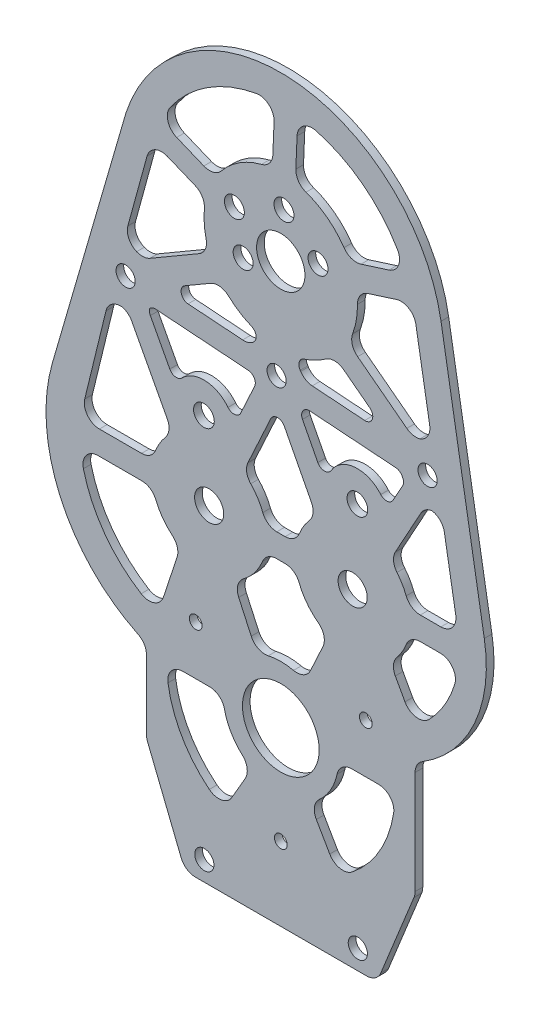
SolidWorks part; units mm, degrees
ref_plane "Front Plane" through (0, 0, 0) normal (0, 0, 1) x (1, 0, 0)
ref_plane "Top Plane" through (0, 0, 0) normal (0, 1, 0) x (1, 0, 0)
ref_plane "Right Plane" through (0, 0, 0) normal (1, 0, 0) x (0, 0, -1)
sketch "Sketch2" plane through (0, 0, 0) normal (0, 0, 1) x (1, 0, 0)
  line L0 (-51.4523, 75.7894) -> (48.4946, 68.6222) construction
  line L1 (22.6673, 116.9272) -> (41.2732, 122.8486)
  line L2 (4.7276, 130.6165) -> (5.527, 150.1256)
  line L3 (24.9782, 109.6661) -> (43.5841, 115.5874)
  line L4 (22.1726, 93.4838) -> (37.6993, 81.6448)
  line L5 (-0.1072, 105.6809) -> (84.2094, 132.5148) construction
  line L6 (-0.1072, 105.6809) -> (5.3603, 239.1239) construction
  line L7 (-2.886, 130.9285) -> (-2.0866, 150.4375)
  line L8 (-0.1072, 105.6809) -> (-82.9144, 139.7207) construction
  line L9 (-0.1072, 105.6809) -> (68.4071, 53.439) construction
  line L10 (-21.8854, 118.7527) -> (-39.9445, 126.1763)
  line L11 (-0.1072, 105.6809) -> (-86.0859, 55.6268) construction
  line L12 (-24.7826, 111.7049) -> (-42.8417, 119.1286)
  line L13 (-23.7269, 96.3389) -> (-45.8247, 83.4742)
  line L14 (-0.1072, 105.6809) -> (-1.4788, 72.2058) construction
  line L15 (-19.8931, 89.7536) -> (-38.8683, 78.7068)
  line L18 (-38.8683, 78.7068) -> (-9.9137, 76.6305)
  line L19 (7.5011, 75.3816) -> (36.0291, 73.3359)
  line L20 (17.5523, 87.4244) -> (36.0291, 73.3359)
  line L21 (51.6238, 69.1598) -> (44.0462, 113.2665) construction
  line L22 (37.6993, 81.6448) -> (43.8628, 76.9451)
  line L23 (44.0462, 113.2665) -> (50.1033, 78.0104)
  line L24 (39.5147, 65.4463) -> (5.0296, 67.9193)
  line L26 (47.6235, 59.1371) -> (36.0334, 38.0767)
  line L27 (-43.3163, 117.5151) -> (-52.1423, 85.2894)
  line L29 (-7.2441, 68.7995) -> (-43.0173, 71.3648)
  line L30 (-1.4788, 72.2058) -> (23.6962, 23.5612) construction
  line L31 (23.6962, 23.5612) -> (48.4946, 68.6222) construction
  line L32 (-51.4523, 75.7894) -> (-23.8033, 23.7713) construction
  line L33 (-23.8033, 23.7713) -> (-1.4788, 72.2058) construction
  line L34 (23.6962, 23.5612) -> (-23.8033, 23.7713) construction
  line L35 (-7.2441, 68.7995) -> (-15.5701, 50.7357)
  line L36 (-43.9907, 69.8691) -> (-34.8925, 52.752)
  line L37 (-1.2807, 63.5337) -> (-12.53, 39.1276)
  line L38 (-5.1215, 27.4987) -> (5.0482, 27.4537)
  line L39 (11.7336, 38.3868) -> (-1.2807, 63.5337)
  line L40 (40.9477, 62.811) -> (34.9343, 51.8841)
  line L42 (-50.7193, 66.2927) -> (-35.928, 38.4646)
  line L43 (51.656, 68.9461) -> (58.82, 27.3712) construction
  line L44 (23.6962, 23.5612) -> (99.3125, 23.5612) construction
  line L48 (-54.5366, 76.5428) -> (-66.4961, 27.5813) construction
  line L49 (-23.8033, 23.7713) -> (-96.1397, 23.7713) construction
  line L51 (-66.4961, 27.5813) -> (-42.4684, 27.5813)
  line L52 (42.3613, 27.3712) -> (58.82, 27.3712)
  line L53 (-42.4243, 19.7512) -> (-66.4769, 19.7512)
  line L54 (5.0311, 19.7512) -> (-5.1823, 19.7512)
  line L55 (58.82, 19.7512) -> (42.3613, 19.7512)
  line L57 (-0.0935, -28.0635) -> (67.2596, -28.0635) construction
  line L58 (-0.0935, -28.0635) -> (42.096, -101.1379) construction
  line L60 (18.7089, 12.7386) -> (-0.0935, -28.0635) construction
  line L61 (25.4, -78.4691) -> (-25.4, -78.4691) construction
  line L70 (-0.0935, -28.0635) -> (-26.1582, 28.9197) construction
  line L71 (-33.2594, 7.2339) -> (-40.7736, -15.5886)
  line L72 (-23.8033, 23.7713) -> (-39.6153, -24.2535) construction
  line L75 (-0.0935, -28.0635) -> (-35.6982, -89.7327) construction
  line L76 (36.019, 9.0336) -> (43.9402, -5.3936)
  line L81 (-0.0935, -28.0635) -> (-53.5455, -28.0635) construction
  line L85 (53.1443, 60.3092) -> (58.82, 27.3712)
  line L86 (-56.6675, 67.8191) -> (-66.4961, 27.5813)
  line L87 (-51.2911, 122.767) -> (-75.6689, 38.8356)
  line L88 (67.2596, 31.252) -> (52.9393, 115.0072)
  line L89 (44.3565, -15.6809) -> (44.3565, -53.7396)
  line L90 (44.3565, -53.7396) -> (31.7098, -84.9746)
  line L91 (31.7098, -84.9746) -> (-31.7902, -84.9746)
  line L92 (-31.7902, -84.9746) -> (-44.5435, -53.2246)
  line L93 (-44.5435, -53.2246) -> (-44.5435, -26.0967)
  line L95 (15.7234, 6.2599) -> (7.8793, -10.7622)
  line L96 (-15.8792, 6.4475) -> (-8.0176, -10.7398)
  line L97 (18.9565, -28.0635) -> (37.699, -28.0635)
  line L101 (9.4315, -44.5613) -> (18.8027, -60.7928)
  line L103 (-9.6185, -44.5613) -> (-18.9897, -60.7928)
  line L105 (-19.1435, -28.0635) -> (-37.886, -28.0635)
  line L106 (15.105, 48.4511) -> (5.0296, 67.9193)
  circle A0 centre (-1.4788, 72.2058) radius 3.175
  arc A1 (22.1726, 93.4838) -> (17.5523, 87.4244) centre (-0.1072, 105.6809) ccw construction
  arc A2 (44.0462, 113.2665) -> (37.6993, 81.6448) centre (-0.1072, 105.6809) ccw construction
  arc A3 (22.1726, 93.4838) -> (24.9782, 109.6661) centre (-0.1072, 105.6809) ccw
  arc A4 (22.6673, 116.9272) -> (4.7276, 130.6165) centre (-0.1072, 105.6809) ccw
  arc A5 (41.2732, 122.8486) -> (5.527, 150.1256) centre (-0.1072, 105.6809) ccw
  arc A6 (44.0462, 113.2665) -> (43.5841, 115.5874) centre (-0.1072, 105.6809) ccw
  arc A7 (-2.886, 130.9285) -> (-21.8854, 118.7527) centre (-0.1072, 105.6809) ccw
  arc A8 (-39.9445, 126.1763) -> (-2.0866, 150.4375) centre (-0.1072, 105.6809) cw
  arc A9 (-23.7269, 96.3389) -> (-24.7826, 111.7049) centre (-0.1072, 105.6809) cw
  circle A11 centre (-1.4788, 72.2058) radius 9.525 construction
  circle A18 centre (23.6962, 23.5612) radius 19.05 construction
  circle A19 centre (-23.8033, 23.7713) radius 19.05 construction
  circle A20 centre (23.6962, 23.5612) radius 35.3298 construction
  arc A21 (43.8628, 76.9451) -> (50.1033, 78.0104) centre (48.4946, 68.6222) cw
  circle A22 centre (48.4946, 68.6222) radius 9.525 construction
  circle A24 centre (-51.4523, 75.7894) radius 9.525 construction
  arc A25 (-42.8417, 119.1286) -> (-43.3163, 117.5151) centre (-0.1072, 105.6809) ccw
  arc A27 (-45.8247, 83.4742) -> (-52.1423, 85.2894) centre (-51.4523, 75.7894) ccw
  circle A28 centre (-23.8033, 23.7713) radius 42.8625 construction
  arc A29 (-43.0173, 71.3648) -> (-43.9907, 69.8691) centre (-51.4523, 75.7894) cw
  arc A33 (-12.53, 39.1276) -> (-5.1215, 27.4987) centre (-23.8033, 23.7713) cw
  arc A34 (5.0482, 27.4537) -> (11.7336, 38.3868) centre (23.6962, 23.5612) cw
  arc A35 (40.9477, 62.811) -> (39.5147, 65.4463) centre (48.4946, 68.6222) cw
  arc A39 (36.0334, 38.0767) -> (42.3613, 27.3712) centre (23.6962, 23.5612) cw
  arc A40 (53.1443, 60.3092) -> (47.6235, 59.1371) centre (48.4946, 68.6222) cw
  arc A43 (-50.7193, 66.2927) -> (-56.6675, 67.8191) centre (-51.4523, 75.7894) cw
  arc A45 (-42.4684, 27.5813) -> (-35.928, 38.4646) centre (-23.8033, 23.7713) cw
  arc A47 (-5.1823, 19.7512) -> (-15.8792, 6.4475) centre (-23.8033, 23.7713) cw
  arc A48 (15.7234, 6.2599) -> (5.0311, 19.7512) centre (23.6962, 23.5612) cw
  arc A49 (-33.2594, 7.2339) -> (-42.4243, 19.7512) centre (-23.8033, 23.7713) cw
  arc A50 (-40.7736, -15.5886) -> (-66.4769, 19.7512) centre (-23.8033, 23.7713) cw
  circle A54 centre (-25.4, -78.4691) radius 9.525 construction
  arc A57 (58.82, 19.7512) -> (43.9402, -5.3936) centre (23.6962, 23.5612) cw
  arc A58 (42.3613, 19.7512) -> (36.019, 9.0336) centre (23.6962, 23.5612) cw
  arc A59 (67.2596, 31.252) -> (44.3565, -15.6809) centre (23.591, 23.5073) cw
  arc A62 (-44.5435, -26.0967) -> (-75.6689, 38.8356) centre (-23.8033, 23.7713) cw
  circle A64 centre (-25.4, -78.4691) radius 3.175
  circle A65 centre (25.4, -78.4691) radius 3.175
  circle A66 centre (23.6962, 23.5612) radius 4.826
  circle A67 centre (-23.8033, 23.7713) radius 4.826
  circle A68 centre (48.4946, 68.6222) radius 3.175
  circle A70 centre (-0.1072, 105.6809) radius 8.001
  arc A71 (-51.2911, 122.767) -> (52.9393, 115.0072) centre (-0.1404, 105.9317) cw
  arc A72 (-19.8931, 89.7536) -> (-5.4711, 80.8537) centre (-0.1072, 105.6809) ccw
  arc A73 (-9.9137, 76.6305) -> (-5.4711, 80.8537) centre (-1.4788, 72.2058) cw
  arc A74 (7.5011, 75.3816) -> (3.2076, 80.4982) centre (-1.4788, 72.2058) ccw
  arc A75 (17.5523, 87.4244) -> (3.2076, 80.4982) centre (-0.1072, 105.6809) cw
  circle A76 centre (-0.0935, -28.0635) radius 12.7
  circle A77 centre (-0.0935, -28.0635) radius 44.45 construction
  circle A79 centre (-0.0935, -28.0635) radius 19.05 construction
  arc A80 (7.8793, -10.7622) -> (-8.0176, -10.7398) centre (-0.0935, -28.0635) ccw
  circle A81 centre (-0.0935, -28.0635) radius 37.7925 construction
  arc A83 (18.9565, -28.0635) -> (9.4315, -44.5613) centre (-0.0935, -28.0635) cw
  arc A85 (37.699, -28.0635) -> (18.8027, -60.7928) centre (-0.0935, -28.0635) cw
  arc A86 (-9.6185, -44.5613) -> (-19.1435, -28.0635) centre (-0.0935, -28.0635) cw
  arc A88 (-18.9897, -60.7928) -> (-37.886, -28.0635) centre (-0.0935, -28.0635) cw
  circle A89 centre (-0.0935, -60.5635) radius 2.1209
  circle A91 centre (-28.2393, -11.8135) radius 2.1209
  circle A92 centre (28.0523, -11.8135) radius 2.1209
  circle A93 centre (12.2309, 111.2205) radius 3.302
  circle A94 centre (0.96, 120.9703) radius 3.302
  circle A95 centre (-15.4499, 113.6088) radius 3.302
  circle A96 centre (-12.5579, 100.4696) radius 3.302
  circle A98 centre (25.2596, 48.7817) radius 3.429
  circle A99 centre (-25.5404, 48.7817) radius 3.429
  arc A100 (-15.5701, 50.7357) -> (-34.8925, 52.752) centre (-25.5404, 48.7817) ccw
  arc A101 (15.105, 48.4511) -> (34.9343, 51.8841) centre (25.2596, 48.7817) cw
  circle A102 centre (-51.4523, 75.7894) radius 3.175
  point P157 (-0.0935, -28.0635)
  dimension "D1" = 6.35
  dimension "D2" = 70
  dimension "D6" = 50.8
  dimension "D11" = 3.81
  dimension "D12" = 19.05
  dimension "D16" = 19.05
  dimension "D21" = 19.05
  dimension "D23" = 85.725
  dimension "D47" = 19.05
  dimension "D58" = 85.5
  dimension "D29" = 25.4
  dimension "D26" = 16.002
  dimension "D60" = 88.9
  dimension "D39" = 38.1
  dimension "D40" = 10.16
  dimension "D37" = 4.2418
  dimension "D42" = 3.81
  dimension "D41" = 10.16
  dimension "D43" = 6.858
  dimension "D44" = 6.858
  dimension "D45" = 9.652
  dimension "D4" = 7.62
  dimension "D5" = 3.81
  dimension "D7" = 3.81
  dimension "D8" = 3.81
  dimension "D9" = 70
  dimension "D10" = 3.81
  dimension "D13" = 3.81
  dimension "D14" = 3.81
  dimension "D15" = 3.81
  dimension "D17" = 32.5
  dimension "D18" = 60
  dimension "D19" = 3.81
  dimension "D20" = 3.81
  dimension "D22" = 3.81
  dimension "D24" = 3.81
  dimension "D25" = 3.81
  dimension "D27" = 3.81
  dimension "D28" = 3.81
  dimension "D30" = 3.81
  dimension "D31" = 3.81
  dimension "D32" = 3.81
  dimension "D33" = 3.81
  dimension "D34" = 3.81
  dimension "D35" = 3.81
  dimension "D36" = 60
  dimension "D38" = 3
  dimension "D48" = 3.81
  dimension "D59" = 47.5
extrude "Boss-Extrude1" add sketch "Sketch2" along normal blind 2.54
fillet "Fillet1" radius 5 9 edges at (-19.8931, 89.7536, 1.27) (-21.8854, 118.7527, 1.27) (18.8027, -60.7928, 1.27) (9.4315, -44.5613, 1.27) (-56.6675, 67.8191, 1.27) (-66.4961, 27.5813, 1.27) (-35.928, 38.4646, 1.27) (-42.4684, 27.5813, 1.27) (-33.2594, 7.2339, 1.27)
fillet "Fillet2" radius 5 12 edges at (-50.7193, 66.2927, 1.27) (58.82, 19.7512, 1.27) (-15.8792, 6.4475, 1.27) (47.6235, 59.1371, 1.27) (36.0334, 38.0767, 1.27) (42.3613, 19.7512, 1.27) (42.3613, 27.3712, 1.27) (-52.1423, 85.2894, 1.27) (17.5523, 87.4244, 1.27) (-24.7826, 111.7049, 1.27) (-42.8417, 119.1286, 1.27) (7.5011, 75.3816, 1.27)
fillet "Fillet3" radius 5 29 edges at (-45.8247, 83.4742, 1.27) (-9.9137, 76.6305, 1.27) (-39.9445, 126.1763, 1.27) (22.1726, 93.4838, 1.27) (43.8628, 76.9451, 1.27) (-42.4243, 19.7512, 1.27) (-2.886, 130.9285, 1.27) (24.9782, 109.6661, 1.27) (22.6673, 116.9272, 1.27) (5.0482, 27.4537, 1.27) (43.5841, 115.5874, 1.27) (43.9402, -5.3936, 1.27) (53.1443, 60.3092, 1.27) (-19.1435, -28.0635, 1.27) (-37.886, -28.0635, 1.27) (-9.6185, -44.5613, 1.27) (5.527, 150.1256, 1.27) (58.82, 27.3712, 1.27) (-18.9897, -60.7928, 1.27) (4.7276, 130.6165, 1.27) (36.019, 9.0336, 1.27) (18.9565, -28.0635, 1.27) (7.8793, -10.7622, 1.27) (-23.7269, 96.3389, 1.27) (37.699, -28.0635, 1.27) (15.7234, 6.2599, 1.27) (-8.0176, -10.7398, 1.27) (-5.1823, 19.7512, 1.27) (5.0311, 19.7512, 1.27)
fillet "Fillet4" radius 5 8 edges at (50.1033, 78.0104, 1.27) (-2.0866, 150.4375, 1.27) (41.2732, 122.8486, 1.27) (-66.4769, 19.7512, 1.27) (-40.7736, -15.5886, 1.27) (-5.1215, 27.4987, 1.27) (11.7336, 38.3868, 1.27) (-12.53, 39.1276, 1.27)
fillet "Fillet5" radius 2.5 15 edges at (36.0291, 73.3359, 1.27) (34.9343, 51.8841, 1.27) (-1.2807, 63.5337, 1.27) (-7.2441, 68.7995, 1.27) (-34.8925, 52.752, 1.27) (15.105, 48.4511, 1.27) (-15.5701, 50.7357, 1.27) (-43.9907, 69.8691, 1.27) (-43.0173, 71.3648, 1.27) (-38.8683, 78.7068, 1.27) (-5.4711, 80.8537, 1.27) (3.2076, 80.4982, 1.27) (5.0296, 67.9193, 1.27) (39.5147, 65.4463, 1.27) (40.9477, 62.811, 1.27)
fillet "Fillet6" radius 5.08 6 edges at (-44.5435, -26.0967, 1.27) (-44.5435, -53.2246, 1.27) (-31.7902, -84.9746, 1.27) (44.3565, -15.6809, 1.27) (44.3565, -53.7396, 1.27) (31.7098, -84.9746, 1.27)
sketch "Sketch3" plane through (0, 0, 0) normal (0, 0, -1) x (-1, 0, 0)
  line L2 (31.8689, 82.7816) -> (23.3351, 87.7498)
  line L3 (12.7249, 76.8321) -> (30.7899, 78.1275)
  line L4 (31.8689, 82.7816) -> (23.3351, 87.7498)
  line L5 (12.7249, 76.8321) -> (30.7899, 78.1275)
  line L6 (-35.7225, 121.0821) -> (-26.4625, 118.1351)
  line L7 (27.1689, 94.3351) -> (43.3891, 84.8922)
  line L8 (37.6413, 116.9908) -> (28.4663, 113.2192)
  line L9 (50.7081, 90.5262) -> (44.3647, 113.6871)
  line L10 (27.1689, 94.3351) -> (43.3891, 84.8922)
  line L11 (37.6413, 116.9908) -> (28.4663, 113.2192)
  line L12 (50.7081, 90.5262) -> (44.3647, 113.6871)
  line L13 (-40.2213, 61.4911) -> (-37.0838, 55.7899)
  line L14 (-9.479, 67.6002) -> (-38.0119, 65.5541)
  line L15 (-12.1696, 54.123) -> (-7.0799, 63.9576)
  line L16 (-40.2213, 61.4911) -> (-37.0838, 55.7899)
  line L17 (-9.479, 67.6002) -> (-38.0119, 65.5541)
  line L18 (-12.1696, 54.123) -> (-7.0799, 63.9576)
  line L19 (-4.8907, 134.596) -> (-5.2885, 144.3054)
  line L20 (-35.7225, 121.0821) -> (-26.4625, 118.1351)
  line L21 (-4.8907, 134.596) -> (-5.2885, 144.3054)
  line L22 (2.3251, 144.6174) -> (2.7229, 134.9079)
  line L23 (-44.6165, 109.9472) -> (-49.1858, 83.3504)
  line L24 (-28.7734, 110.8739) -> (-38.1724, 113.8652)
  line L25 (-41.6216, 78.654) -> (-25.3397, 91.0689)
  line L26 (-44.6165, 109.9472) -> (-49.1858, 83.3504)
  line L27 (-28.7734, 110.8739) -> (-38.1724, 113.8652)
  line L28 (-41.6216, 78.654) -> (-25.3397, 91.0689)
  line L29 (25.5691, 120.267) -> (34.557, 123.9616)
  line L30 (2.3251, 144.6174) -> (2.7229, 134.9079)
  line L31 (25.5691, 120.267) -> (34.557, 123.9616)
  line L32 (-27.6708, 73.9352) -> (-10.3123, 75.18)
  line L33 (-20.7194, 85.0094) -> (-29.3655, 78.4169)
  line L34 (-27.6708, 73.9352) -> (-10.3123, 75.18)
  line L35 (-20.7194, 85.0094) -> (-29.3655, 78.4169)
  line L36 (-23.431, -28.0635) -> (-32.3155, -28.0635)
  line L37 (-52.8848, 27.3712) -> (-46.0745, 27.3712)
  line L38 (-54.0394, 55.1145) -> (-57.8121, 33.2203)
  line L39 (-37.8236, 41.3297) -> (-46.2647, 56.668)
  line L40 (-52.8848, 27.3712) -> (-46.0745, 27.3712)
  line L41 (-54.0394, 55.1145) -> (-57.8121, 33.2203)
  line L42 (-37.8236, 41.3297) -> (-46.2647, 56.668)
  line L43 (1.5089, 19.7512) -> (-1.318, 19.7512)
  line L44 (9.8788, -6.6707) -> (14.018, 2.3785)
  line L45 (-13.8507, 2.1961) -> (-9.752, -6.6984)
  line L46 (1.5089, 19.7512) -> (-1.318, 19.7512)
  line L47 (9.8788, -6.6707) -> (14.018, 2.3785)
  line L48 (-13.8507, 2.1961) -> (-9.752, -6.6984)
  line L49 (36.8407, 56.4173) -> (43.2836, 68.5387)
  line L50 (8.7567, 65.5178) -> (13.3358, 55.5831)
  line L51 (41.5146, 71.257) -> (10.8483, 69.0579)
  line L52 (36.8407, 56.4173) -> (43.2836, 68.5387)
  line L53 (8.7567, 65.5178) -> (13.3358, 55.5831)
  line L54 (41.5146, 71.257) -> (10.8483, 69.0579)
  line L55 (-1.335, 27.4701) -> (1.4084, 27.4823)
  line L56 (-1.0695, 58.9924) -> (-10.0269, 41.6845)
  line L57 (10.9757, 42.4997) -> (3.4212, 58.8898)
  line L58 (-1.335, 27.4701) -> (1.4084, 27.4823)
  line L59 (-1.0695, 58.9924) -> (-10.0269, 41.6845)
  line L60 (10.9757, 42.4997) -> (3.4212, 58.8898)
  line L61 (-16.111, -56.1306) -> (-11.6688, -48.4363)
  line L62 (-23.431, -28.0635) -> (-32.3155, -28.0635)
  line L63 (-16.111, -56.1306) -> (-11.6688, -48.4363)
  line L64 (34.4206, 3.707) -> (38.938, -10.0135)
  line L65 (49.4182, 63.8449) -> (37.6707, 41.7434)
  line L66 (64.985, 33.7677) -> (57.9559, 62.5445)
  line L67 (46.1816, 27.5813) -> (60.1278, 27.5813)
  line L68 (49.4182, 63.8449) -> (37.6707, 41.7434)
  line L69 (64.985, 33.7677) -> (57.9559, 62.5445)
  line L70 (46.1816, 27.5813) -> (60.1278, 27.5813)
  line L71 (60.5757, 19.7512) -> (46.0977, 19.7512)
  line L72 (34.4206, 3.707) -> (38.938, -10.0135)
  line L73 (60.5757, 19.7512) -> (46.0977, 19.7512)
  line L74 (-41.0036, -0.045) -> (-37.8061, 5.7788)
  line L75 (-46.0745, 19.7512) -> (-52.7183, 19.7512)
  line L76 (-41.0036, -0.045) -> (-37.8061, 5.7788)
  line L77 (-46.0745, 19.7512) -> (-52.7183, 19.7512)
  line L78 (11.8558, -48.4363) -> (16.298, -56.1306)
  line L79 (32.5025, -28.0635) -> (23.618, -28.0635)
  line L80 (11.8558, -48.4363) -> (16.298, -56.1306)
  line L81 (32.5025, -28.0635) -> (23.618, -28.0635)
  line L87 (33.0701, -81.7881) -> (44.1774, -54.136)
  line L88 (44.5435, -52.2425) -> (44.5435, -29.3779)
  line L89 (75.6689, 38.8356) -> (51.2911, 122.767)
  line L90 (-52.9393, 115.0072) -> (-67.2596, 31.252)
  line L91 (-44.3565, -18.6274) -> (-44.3565, -52.7502)
  line L92 (-43.9852, -54.6567) -> (-32.9947, -81.8011)
  line L93 (-28.2861, -84.9746) -> (28.3562, -84.9746)
  line L94 (33.0701, -81.7881) -> (44.1774, -54.136)
  line L95 (44.5435, -52.2425) -> (44.5435, -29.3779)
  line L96 (75.6689, 38.8356) -> (51.2911, 122.767)
  line L97 (-52.9393, 115.0072) -> (-67.2596, 31.252)
  line L98 (-44.3565, -18.6274) -> (-44.3565, -52.7502)
  line L99 (-43.9852, -54.6567) -> (-32.9947, -81.8011)
  line L100 (-28.2861, -84.9746) -> (28.3562, -84.9746)
  circle A1 centre (1.4788, 72.2058) radius 3.175
  circle A2 centre (1.4788, 72.2058) radius 3.175
  circle A3 centre (0.0935, -28.0635) radius 12.7
  circle A4 centre (0.0935, -28.0635) radius 12.7
  arc A5 (30.7899, 78.1275) -> (31.8689, 82.7816) centre (30.6111, 80.6211) ccw
  arc A6 (9.1682, 77.9765) -> (12.7249, 76.8321) centre (12.3672, 81.8192) ccw
  arc A7 (9.8125, 82.2082) -> (9.1682, 77.9765) centre (10.7677, 79.8979) ccw
  arc A8 (9.8125, 82.2082) -> (17.4129, 87.0886) centre (0.1072, 105.6809) ccw
  arc A9 (23.3351, 87.7498) -> (17.4129, 87.0886) centre (20.8195, 83.4287) ccw
  arc A10 (30.7899, 78.1275) -> (31.8689, 82.7816) centre (30.6111, 80.6211) ccw
  arc A11 (9.1682, 77.9765) -> (12.7249, 76.8321) centre (12.3672, 81.8192) ccw
  arc A12 (9.8125, 82.2082) -> (9.1682, 77.9765) centre (10.7677, 79.8979) ccw
  arc A13 (9.8125, 82.2082) -> (17.4129, 87.0886) centre (0.1072, 105.6809) ccw
  arc A14 (23.3351, 87.7498) -> (17.4129, 87.0886) centre (20.8195, 83.4287) ccw
  circle A15 centre (51.4523, 75.7894) radius 3.175
  circle A16 centre (51.4523, 75.7894) radius 3.175
  circle A17 centre (0.0935, -60.5635) radius 2.1209
  arc A18 (47.8019, 84.5872) -> (50.7081, 90.5262) centre (45.8857, 89.2054) ccw
  arc A19 (43.3891, 84.8922) -> (47.8019, 84.5872) centre (45.9047, 89.2133) ccw
  arc A20 (24.8198, 99.8116) -> (27.1689, 94.3351) centre (29.6845, 98.6562) ccw
  arc A21 (24.8198, 99.8116) -> (25.3903, 108.1155) centre (0.1072, 105.6809) ccw
  arc A22 (28.4663, 113.2192) -> (25.3903, 108.1155) centre (30.3673, 108.5947) ccw
  arc A23 (44.3647, 113.6871) -> (37.6413, 116.9908) centre (39.5423, 112.3663) ccw
  arc A24 (47.8019, 84.5872) -> (50.7081, 90.5262) centre (45.8857, 89.2054) ccw
  arc A25 (43.3891, 84.8922) -> (47.8019, 84.5872) centre (45.9047, 89.2133) ccw
  arc A26 (24.8198, 99.8116) -> (27.1689, 94.3351) centre (29.6845, 98.6562) ccw
  arc A27 (24.8198, 99.8116) -> (25.3903, 108.1155) centre (0.1072, 105.6809) ccw
  arc A28 (28.4663, 113.2192) -> (25.3903, 108.1155) centre (30.3673, 108.5947) ccw
  arc A29 (44.3647, 113.6871) -> (37.6413, 116.9908) centre (39.5423, 112.3663) ccw
  arc A30 (-8.2428, 129.6692) -> (-20.8256, 120.0676) centre (0.1072, 105.6809) ccw
  arc A31 (-16.5363, 53.9904) -> (-32.9911, 55.3733) centre (-25.2596, 48.7817) ccw
  arc A32 (-37.0838, 55.7899) -> (-32.9911, 55.3733) centre (-34.8936, 56.9953) ccw
  arc A33 (-40.2064, 63.9284) -> (-40.2213, 61.4911) centre (-38.0311, 62.6964) ccw
  arc A34 (-40.2064, 63.9284) -> (-40.0496, 64.2168) centre (-48.4946, 68.6222) ccw
  arc A35 (-38.0119, 65.5541) -> (-40.0496, 64.2168) centre (-37.8331, 63.0605) ccw
  arc A36 (-7.0799, 63.9576) -> (-9.479, 67.6002) centre (-9.3002, 65.1066) ccw
  arc A37 (-16.5363, 53.9904) -> (-12.1696, 54.123) centre (-14.3899, 55.2721) ccw
  arc A38 (-16.5363, 53.9904) -> (-32.9911, 55.3733) centre (-25.2596, 48.7817) ccw
  arc A39 (-37.0838, 55.7899) -> (-32.9911, 55.3733) centre (-34.8936, 56.9953) ccw
  arc A40 (-40.2064, 63.9284) -> (-40.2213, 61.4911) centre (-38.0311, 62.6964) ccw
  arc A41 (-40.2064, 63.9284) -> (-40.0496, 64.2168) centre (-48.4946, 68.6222) ccw
  arc A42 (-38.0119, 65.5541) -> (-40.0496, 64.2168) centre (-37.8331, 63.0605) ccw
  arc A43 (-7.0799, 63.9576) -> (-9.479, 67.6002) centre (-9.3002, 65.1066) ccw
  arc A44 (-16.5363, 53.9904) -> (-12.1696, 54.123) centre (-14.3899, 55.2721) ccw
  arc A45 (-26.4625, 118.1351) -> (-20.8256, 120.0676) centre (-24.9462, 122.8996) ccw
  arc A46 (-38.5169, 128.38) -> (-35.7225, 121.0821) centre (-34.2062, 125.8466) ccw
  arc A47 (-11.5898, 148.9273) -> (-38.5169, 128.38) centre (0.1072, 105.6809) ccw
  arc A48 (-5.2885, 144.3054) -> (-11.5898, 148.9273) centre (-10.2843, 144.1007) ccw
  arc A49 (-8.2428, 129.6692) -> (-4.8907, 134.596) centre (-9.8865, 134.3913) ccw
  arc A50 (-8.2428, 129.6692) -> (-20.8256, 120.0676) centre (0.1072, 105.6809) ccw
  arc A51 (-26.4625, 118.1351) -> (-20.8256, 120.0676) centre (-24.9462, 122.8996) ccw
  arc A52 (-38.5169, 128.38) -> (-35.7225, 121.0821) centre (-34.2062, 125.8466) ccw
  arc A53 (-11.5898, 148.9273) -> (-38.5169, 128.38) centre (0.1072, 105.6809) ccw
  arc A54 (-5.2885, 144.3054) -> (-11.5898, 148.9273) centre (-10.2843, 144.1007) ccw
  arc A55 (-8.2428, 129.6692) -> (-4.8907, 134.596) centre (-9.8865, 134.3913) ccw
  arc A56 (-45.9757, 77.808) -> (-41.6216, 78.654) centre (-44.6534, 82.63) ccw
  arc A57 (-49.1858, 83.3504) -> (-45.9757, 77.808) centre (-44.258, 82.5038) ccw
  arc A58 (-38.1724, 113.8652) -> (-44.6165, 109.9472) centre (-39.6887, 109.1006) ccw
  arc A59 (-25.2902, 106.0389) -> (-28.7734, 110.8739) centre (-30.2897, 106.1094) ccw
  arc A60 (-25.2902, 106.0389) -> (-23.6874, 96.7943) centre (0.1072, 105.6809) ccw
  arc A61 (-25.3397, 91.0689) -> (-23.6874, 96.7943) centre (-28.3714, 95.0449) ccw
  arc A62 (-45.9757, 77.808) -> (-41.6216, 78.654) centre (-44.6534, 82.63) ccw
  arc A63 (-49.1858, 83.3504) -> (-45.9757, 77.808) centre (-44.258, 82.5038) ccw
  arc A64 (-38.1724, 113.8652) -> (-44.6165, 109.9472) centre (-39.6887, 109.1006) ccw
  arc A65 (-25.2902, 106.0389) -> (-28.7734, 110.8739) centre (-30.2897, 106.1094) ccw
  arc A66 (-25.2902, 106.0389) -> (-23.6874, 96.7943) centre (0.1072, 105.6809) ccw
  arc A67 (-25.3397, 91.0689) -> (-23.6874, 96.7943) centre (-28.3714, 95.0449) ccw
  arc A68 (8.2271, 149.7393) -> (2.3251, 144.6174) centre (7.3209, 144.8221) ccw
  arc A69 (36.7449, 131.4637) -> (8.2271, 149.7393) centre (0.1072, 105.6809) ccw
  arc A70 (34.557, 123.9616) -> (36.7449, 131.4637) centre (32.6559, 128.5861) ccw
  arc A71 (19.793, 121.7319) -> (25.5691, 120.267) centre (23.6681, 124.8915) ccw
  arc A72 (19.793, 121.7319) -> (6.4668, 130.2719) centre (0.1072, 105.6809) ccw
  arc A73 (2.7229, 134.9079) -> (6.4668, 130.2719) centre (7.7187, 135.1126) ccw
  arc A74 (8.2271, 149.7393) -> (2.3251, 144.6174) centre (7.3209, 144.8221) ccw
  arc A75 (36.7449, 131.4637) -> (8.2271, 149.7393) centre (0.1072, 105.6809) ccw
  arc A76 (34.557, 123.9616) -> (36.7449, 131.4637) centre (32.6559, 128.5861) ccw
  arc A77 (19.793, 121.7319) -> (25.5691, 120.267) centre (23.6681, 124.8915) ccw
  arc A78 (19.793, 121.7319) -> (6.4668, 130.2719) centre (0.1072, 105.6809) ccw
  arc A79 (2.7229, 134.9079) -> (6.4668, 130.2719) centre (7.7187, 135.1126) ccw
  arc A80 (-29.3655, 78.4169) -> (-27.6708, 73.9352) centre (-27.8496, 76.4288) ccw
  arc A81 (-14.7609, 85.0873) -> (-20.7194, 85.0094) centre (-17.6877, 81.0334) ccw
  arc A82 (-14.7609, 85.0873) -> (-7.6131, 81.4827) centre (0.1072, 105.6809) ccw
  arc A83 (-6.3248, 77.6674) -> (-7.6131, 81.4827) centre (-8.373, 79.1009) ccw
  arc A84 (-6.3248, 77.6674) -> (-6.4879, 77.4266) centre (1.4788, 72.2058) ccw
  arc A85 (-10.3123, 75.18) -> (-6.4879, 77.4266) centre (-10.6699, 80.1672) ccw
  arc A86 (-29.3655, 78.4169) -> (-27.6708, 73.9352) centre (-27.8496, 76.4288) ccw
  arc A87 (-14.7609, 85.0873) -> (-20.7194, 85.0094) centre (-17.6877, 81.0334) ccw
  arc A88 (-14.7609, 85.0873) -> (-7.6131, 81.4827) centre (0.1072, 105.6809) ccw
  arc A89 (-6.3248, 77.6674) -> (-7.6131, 81.4827) centre (-8.373, 79.1009) ccw
  arc A90 (-6.3248, 77.6674) -> (-6.4879, 77.4266) centre (1.4788, 72.2058) ccw
  arc A91 (-10.3123, 75.18) -> (-6.4879, 77.4266) centre (-10.6699, 80.1672) ccw
  circle A92 centre (0.0935, -60.5635) radius 2.1209
  circle A93 centre (28.2393, -11.8135) radius 2.1209
  arc A94 (-57.8121, 33.2203) -> (-52.8848, 27.3712) centre (-52.8848, 32.3712) ccw
  arc A95 (-49.9049, 59.2021) -> (-54.0394, 55.1145) centre (-49.1121, 54.2654) ccw
  arc A96 (-46.2647, 56.668) -> (-49.9049, 59.2021) centre (-50.6452, 54.2573) ccw
  arc A97 (-38.3563, 35.7261) -> (-37.8236, 41.3297) centre (-42.2041, 38.919) ccw
  arc A98 (-38.3563, 35.7261) -> (-41.422, 30.5396) centre (-23.6962, 23.5612) ccw
  arc A99 (-46.0745, 27.3712) -> (-41.422, 30.5396) centre (-46.0745, 32.3712) ccw
  arc A100 (-57.8121, 33.2203) -> (-52.8848, 27.3712) centre (-52.8848, 32.3712) ccw
  arc A101 (-49.9049, 59.2021) -> (-54.0394, 55.1145) centre (-49.1121, 54.2654) ccw
  arc A102 (-46.2647, 56.668) -> (-49.9049, 59.2021) centre (-50.6452, 54.2573) ccw
  arc A103 (-38.3563, 35.7261) -> (-37.8236, 41.3297) centre (-42.2041, 38.919) ccw
  arc A104 (-38.3563, 35.7261) -> (-41.422, 30.5396) centre (-23.6962, 23.5612) ccw
  arc A105 (-46.0745, 27.3712) -> (-41.422, 30.5396) centre (-46.0745, 32.3712) ccw
  arc A106 (32.8376, 55.8511) -> (36.8407, 56.4173) centre (34.6332, 57.5907) ccw
  arc A107 (32.8376, 55.8511) -> (17.568, 55.0798) centre (25.5404, 48.7817) ccw
  arc A108 (13.3358, 55.5831) -> (17.568, 55.0798) centre (15.6063, 56.6296) ccw
  arc A109 (6.1439, 16.6265) -> (1.5089, 19.7512) centre (1.5089, 14.7512) ccw
  arc A110 (6.1439, 16.6265) -> (12.4508, 8.4735) centre (23.8033, 23.7713) ccw
  arc A111 (14.018, 2.3785) -> (12.4508, 8.4735) centre (9.4711, 4.4583) ccw
  arc A112 (4.2428, -9.4709) -> (9.8788, -6.6707) centre (5.3319, -4.5909) ccw
  arc A113 (4.2428, -9.4709) -> (-4.1082, -9.4827) centre (0.0935, -28.0635) ccw
  arc A114 (-9.752, -6.6984) -> (-4.1082, -9.4827) centre (-5.2109, -4.6058) ccw
  arc A115 (-12.3007, 8.2955) -> (-13.8507, 2.1961) centre (-9.3097, 4.2887) ccw
  arc A116 (-12.3007, 8.2955) -> (-5.9704, 16.5828) centre (-23.6962, 23.5612) ccw
  arc A117 (-1.318, 19.7512) -> (-5.9704, 16.5828) centre (-1.318, 14.7512) ccw
  arc A118 (6.1439, 16.6265) -> (1.5089, 19.7512) centre (1.5089, 14.7512) ccw
  arc A119 (6.1439, 16.6265) -> (12.4508, 8.4735) centre (23.8033, 23.7713) ccw
  arc A120 (14.018, 2.3785) -> (12.4508, 8.4735) centre (9.4711, 4.4583) ccw
  arc A121 (4.2428, -9.4709) -> (9.8788, -6.6707) centre (5.3319, -4.5909) ccw
  arc A122 (4.2428, -9.4709) -> (-4.1082, -9.4827) centre (0.0935, -28.0635) ccw
  arc A123 (-9.752, -6.6984) -> (-4.1082, -9.4827) centre (-5.2109, -4.6058) ccw
  arc A124 (-12.3007, 8.2955) -> (-13.8507, 2.1961) centre (-9.3097, 4.2887) ccw
  arc A125 (-12.3007, 8.2955) -> (-5.9704, 16.5828) centre (-23.6962, 23.5612) ccw
  arc A126 (-1.318, 19.7512) -> (-5.9704, 16.5828) centre (-1.318, 14.7512) ccw
  arc A127 (10.8483, 69.0579) -> (8.7567, 65.5178) centre (11.0271, 66.5643) ccw
  arc A128 (43.4257, 70.566) -> (41.5146, 71.257) centre (41.6934, 68.7634) ccw
  arc A129 (43.2836, 68.5387) -> (43.4257, 70.566) centre (41.076, 69.7121) ccw
  arc A130 (32.8376, 55.8511) -> (36.8407, 56.4173) centre (34.6332, 57.5907) ccw
  arc A131 (32.8376, 55.8511) -> (17.568, 55.0798) centre (25.5404, 48.7817) ccw
  arc A132 (13.3358, 55.5831) -> (17.568, 55.0798) centre (15.6063, 56.6296) ccw
  arc A133 (10.8483, 69.0579) -> (8.7567, 65.5178) centre (11.0271, 66.5643) ccw
  arc A134 (43.4257, 70.566) -> (41.5146, 71.257) centre (41.6934, 68.7634) ccw
  arc A135 (43.2836, 68.5387) -> (43.4257, 70.566) centre (41.076, 69.7121) ccw
  arc A136 (-37.2571, -33.8259) -> (-23.5721, -57.5289) centre (0.0935, -28.0635) ccw
  arc A137 (10.0458, 36.9482) -> (6.0468, 30.6712) centre (23.8033, 23.7713) ccw
  arc A138 (1.4084, 27.4823) -> (6.0468, 30.6712) centre (1.3863, 32.4822) ccw
  arc A139 (-6.0015, 30.6179) -> (-1.335, 27.4701) centre (-1.3572, 32.4701) ccw
  arc A140 (-6.0015, 30.6179) -> (-9.3514, 36.0963) centre (-23.6962, 23.5612) ccw
  arc A141 (-10.0269, 41.6845) -> (-9.3514, 36.0963) centre (-5.5863, 39.3863) ccw
  arc A142 (3.4212, 58.8898) -> (-1.0695, 58.9924) centre (1.1508, 57.8433) ccw
  arc A143 (10.0458, 36.9482) -> (10.9757, 42.4997) centre (6.4349, 40.4068) ccw
  arc A144 (10.0458, 36.9482) -> (6.0468, 30.6712) centre (23.8033, 23.7713) ccw
  arc A145 (1.4084, 27.4823) -> (6.0468, 30.6712) centre (1.3863, 32.4822) ccw
  arc A146 (-6.0015, 30.6179) -> (-1.335, 27.4701) centre (-1.3572, 32.4701) ccw
  arc A147 (-6.0015, 30.6179) -> (-9.3514, 36.0963) centre (-23.6962, 23.5612) ccw
  arc A148 (-10.0269, 41.6845) -> (-9.3514, 36.0963) centre (-5.5863, 39.3863) ccw
  arc A149 (3.4212, 58.8898) -> (-1.0695, 58.9924) centre (1.1508, 57.8433) ccw
  arc A150 (10.0458, 36.9482) -> (10.9757, 42.4997) centre (6.4349, 40.4068) ccw
  arc A151 (-32.3155, -28.0635) -> (-37.2571, -33.8259) centre (-32.3155, -33.0635) ccw
  arc A152 (-18.5403, -32.024) -> (-23.431, -28.0635) centre (-23.431, -33.0635) ccw
  arc A153 (-18.5403, -32.024) -> (-12.6533, -42.2206) centre (0.0935, -28.0635) ccw
  arc A154 (-11.6688, -48.4363) -> (-12.6533, -42.2206) centre (-15.9989, -45.9363) ccw
  arc A155 (-23.5721, -57.5289) -> (-16.111, -56.1306) centre (-20.4411, -53.6306) ccw
  arc A156 (-37.2571, -33.8259) -> (-23.5721, -57.5289) centre (0.0935, -28.0635) ccw
  arc A157 (-32.3155, -28.0635) -> (-37.2571, -33.8259) centre (-32.3155, -33.0635) ccw
  arc A158 (-18.5403, -32.024) -> (-23.431, -28.0635) centre (-23.431, -33.0635) ccw
  arc A159 (-18.5403, -32.024) -> (-12.6533, -42.2206) centre (0.0935, -28.0635) ccw
  arc A160 (-11.6688, -48.4363) -> (-12.6533, -42.2206) centre (-15.9989, -45.9363) ccw
  arc A161 (-23.5721, -57.5289) -> (-16.111, -56.1306) centre (-20.4411, -53.6306) ccw
  circle A162 centre (28.2393, -11.8135) radius 2.1209
  circle A163 centre (-28.0523, -11.8135) radius 2.1209
  arc A164 (41.5291, 30.7497) -> (38.2848, 36.1482) centre (23.8033, 23.7713) ccw
  arc A165 (37.6707, 41.7434) -> (38.2848, 36.1482) centre (42.0858, 39.3967) ccw
  arc A166 (52.5319, 66.3258) -> (49.4182, 63.8449) centre (53.8333, 61.4981) ccw
  arc A167 (57.9559, 62.5445) -> (52.5319, 66.3258) centre (53.0987, 61.3581) ccw
  arc A168 (60.1278, 27.5813) -> (64.985, 33.7677) centre (60.1278, 32.5813) ccw
  arc A169 (41.5291, 30.7497) -> (46.1816, 27.5813) centre (46.1816, 32.5813) ccw
  arc A170 (41.5291, 30.7497) -> (38.2848, 36.1482) centre (23.8033, 23.7713) ccw
  arc A171 (37.6707, 41.7434) -> (38.2848, 36.1482) centre (42.0858, 39.3967) ccw
  arc A172 (52.5319, 66.3258) -> (49.4182, 63.8449) centre (53.8333, 61.4981) ccw
  arc A173 (57.9559, 62.5445) -> (52.5319, 66.3258) centre (53.0987, 61.3581) ccw
  arc A174 (60.1278, 27.5813) -> (64.985, 33.7677) centre (60.1278, 32.5813) ccw
  arc A175 (41.5291, 30.7497) -> (46.1816, 27.5813) centre (46.1816, 32.5813) ccw
  arc A176 (46.313, -12.7048) -> (65.4317, 13.5601) centre (23.8033, 23.7713) ccw
  arc A177 (38.938, -10.0135) -> (46.313, -12.7048) centre (43.6872, -8.4498) ccw
  arc A178 (35.9751, 9.1169) -> (34.4206, 3.707) centre (39.1698, 5.2707) ccw
  arc A179 (35.9751, 9.1169) -> (41.4627, 16.6265) centre (23.8033, 23.7713) ccw
  arc A180 (46.0977, 19.7512) -> (41.4627, 16.6265) centre (46.0977, 14.7512) ccw
  arc A181 (65.4317, 13.5601) -> (60.5757, 19.7512) centre (60.5757, 14.7512) ccw
  arc A182 (46.313, -12.7048) -> (65.4317, 13.5601) centre (23.8033, 23.7713) ccw
  arc A183 (38.938, -10.0135) -> (46.313, -12.7048) centre (43.6872, -8.4498) ccw
  arc A184 (35.9751, 9.1169) -> (34.4206, 3.707) centre (39.1698, 5.2707) ccw
  arc A185 (35.9751, 9.1169) -> (41.4627, 16.6265) centre (23.8033, 23.7713) ccw
  arc A186 (46.0977, 19.7512) -> (41.4627, 16.6265) centre (46.0977, 14.7512) ccw
  arc A187 (65.4317, 13.5601) -> (60.5757, 19.7512) centre (60.5757, 14.7512) ccw
  arc A188 (-41.422, 16.5828) -> (-38.3443, 11.3818) centre (-23.6962, 23.5612) ccw
  arc A189 (-37.8061, 5.7788) -> (-38.3443, 11.3818) centre (-42.1889, 8.1852) ccw
  arc A190 (-48.9622, -1.1335) -> (-41.0036, -0.045) centre (-45.3864, 2.3614) ccw
  arc A191 (-57.5028, 13.2989) -> (-48.9622, -1.1335) centre (-23.6962, 23.5612) ccw
  arc A192 (-52.7183, 19.7512) -> (-57.5028, 13.2989) centre (-52.7183, 14.7512) ccw
  arc A193 (-41.422, 16.5828) -> (-46.0745, 19.7512) centre (-46.0745, 14.7512) ccw
  arc A194 (-41.422, 16.5828) -> (-38.3443, 11.3818) centre (-23.6962, 23.5612) ccw
  arc A195 (-37.8061, 5.7788) -> (-38.3443, 11.3818) centre (-42.1889, 8.1852) ccw
  arc A196 (-48.9622, -1.1335) -> (-41.0036, -0.045) centre (-45.3864, 2.3614) ccw
  arc A197 (-57.5028, 13.2989) -> (-48.9622, -1.1335) centre (-23.6962, 23.5612) ccw
  arc A198 (-52.7183, 19.7512) -> (-57.5028, 13.2989) centre (-52.7183, 14.7512) ccw
  arc A199 (-41.422, 16.5828) -> (-46.0745, 19.7512) centre (-46.0745, 14.7512) ccw
  arc A200 (23.7592, -57.5289) -> (37.4441, -33.8259) centre (0.0935, -28.0635) ccw
  arc A201 (16.298, -56.1306) -> (23.7592, -57.5289) centre (20.6281, -53.6306) ccw
  arc A202 (12.8403, -42.2206) -> (11.8558, -48.4363) centre (16.1859, -45.9363) ccw
  arc A203 (12.8403, -42.2206) -> (18.7273, -32.024) centre (0.0935, -28.0635) ccw
  arc A204 (23.618, -28.0635) -> (18.7273, -32.024) centre (23.618, -33.0635) ccw
  arc A205 (37.4441, -33.8259) -> (32.5025, -28.0635) centre (32.5025, -33.0635) ccw
  arc A206 (23.7592, -57.5289) -> (37.4441, -33.8259) centre (0.0935, -28.0635) ccw
  arc A207 (16.298, -56.1306) -> (23.7592, -57.5289) centre (20.6281, -53.6306) ccw
  arc A208 (12.8403, -42.2206) -> (11.8558, -48.4363) centre (16.1859, -45.9363) ccw
  arc A209 (12.8403, -42.2206) -> (18.7273, -32.024) centre (0.0935, -28.0635) ccw
  arc A210 (23.618, -28.0635) -> (18.7273, -32.024) centre (23.618, -33.0635) ccw
  arc A211 (37.4441, -33.8259) -> (32.5025, -28.0635) centre (32.5025, -33.0635) ccw
  circle A212 centre (-28.0523, -11.8135) radius 2.1209
  circle A213 centre (-12.2309, 111.2205) radius 3.302
  circle A214 centre (-12.2309, 111.2205) radius 3.302
  circle A215 centre (-0.96, 120.9703) radius 3.302
  circle A216 centre (-0.96, 120.9703) radius 3.302
  circle A217 centre (15.4499, 113.6088) radius 3.302
  circle A218 centre (15.4499, 113.6088) radius 3.302
  circle A219 centre (12.5579, 100.4696) radius 3.302
  circle A220 centre (12.5579, 100.4696) radius 3.302
  circle A221 centre (-25.2596, 48.7817) radius 3.429
  circle A222 centre (-25.2596, 48.7817) radius 3.429
  circle A223 centre (25.5404, 48.7817) radius 3.429
  circle A224 centre (25.5404, 48.7817) radius 3.429
  circle A225 centre (25.4, -78.4691) radius 3.175
  circle A226 centre (25.4, -78.4691) radius 3.175
  circle A227 centre (-25.4, -78.4691) radius 3.175
  circle A228 centre (-25.4, -78.4691) radius 3.175
  circle A229 centre (-23.6962, 23.5612) radius 4.826
  circle A230 centre (-23.6962, 23.5612) radius 4.826
  circle A231 centre (23.8033, 23.7713) radius 4.826
  circle A232 centre (23.8033, 23.7713) radius 4.826
  circle A233 centre (-48.4946, 68.6222) radius 3.175
  circle A234 centre (-48.4946, 68.6222) radius 3.175
  circle A235 centre (0.1072, 105.6809) radius 8.001
  circle A236 centre (0.1072, 105.6809) radius 8.001
  arc A245 (44.1774, -54.136) -> (44.5435, -52.2425) centre (39.4635, -52.2425) ccw
  arc A246 (47.4037, -24.8085) -> (44.5435, -29.3779) centre (49.6235, -29.3779) ccw
  arc A247 (47.4037, -24.8085) -> (75.6689, 38.8356) centre (23.8033, 23.7713) ccw
  arc A248 (51.2911, 122.767) -> (-52.9393, 115.0072) centre (0.1404, 105.9317) ccw
  arc A249 (-67.2596, 31.252) -> (-46.7803, -14.2972) centre (-23.591, 23.5073) ccw
  arc A250 (-44.3565, -18.6274) -> (-46.7803, -14.2972) centre (-49.4365, -18.6274) ccw
  arc A251 (-44.3565, -52.7502) -> (-43.9852, -54.6567) centre (-39.2765, -52.7502) ccw
  arc A252 (-32.9947, -81.8011) -> (-28.2861, -84.9746) centre (-28.2861, -79.8946) ccw
  arc A253 (28.3562, -84.9746) -> (33.0701, -81.7881) centre (28.3562, -79.8946) ccw
  arc A254 (44.1774, -54.136) -> (44.5435, -52.2425) centre (39.4635, -52.2425) ccw
  arc A255 (47.4037, -24.8085) -> (44.5435, -29.3779) centre (49.6235, -29.3779) ccw
  arc A256 (47.4037, -24.8085) -> (75.6689, 38.8356) centre (23.8033, 23.7713) ccw
  arc A257 (51.2911, 122.767) -> (-52.9393, 115.0072) centre (0.1404, 105.9317) ccw
  arc A258 (-67.2596, 31.252) -> (-46.7803, -14.2972) centre (-23.591, 23.5073) ccw
  arc A259 (-44.3565, -18.6274) -> (-46.7803, -14.2972) centre (-49.4365, -18.6274) ccw
  arc A260 (-44.3565, -52.7502) -> (-43.9852, -54.6567) centre (-39.2765, -52.7502) ccw
  arc A261 (-32.9947, -81.8011) -> (-28.2861, -84.9746) centre (-28.2861, -79.8946) ccw
  arc A262 (28.3562, -84.9746) -> (33.0701, -81.7881) centre (28.3562, -79.8946) ccw
  dimension "D1" = 0
  dimension "D2" = 0
  dimension "D3" = 0
  dimension "D4" = 0
  dimension "D5" = 0
  dimension "D6" = 0
  dimension "D7" = 0
  dimension "D8" = 0
  dimension "D9" = 0
  dimension "D10" = 0
  dimension "D11" = 0
  dimension "D12" = 0
  dimension "D13" = 0
  dimension "D14" = 0
  dimension "D15" = 0
  dimension "D16" = 0
  dimension "D17" = 0
  dimension "D18" = 0
  dimension "D19" = 0
  dimension "D20" = 0
  dimension "D21" = 0
  dimension "D22" = 0
  dimension "D23" = 0
  dimension "D24" = 0
  dimension "D25" = 0
  dimension "D26" = 0
  dimension "D27" = 0
  dimension "D28" = 0
  dimension "D29" = 0
  dimension "D30" = 0
  dimension "D31" = 0
  dimension "D32" = 0
  dimension "D33" = 0
  dimension "D34" = 0
  dimension "D35" = 0
